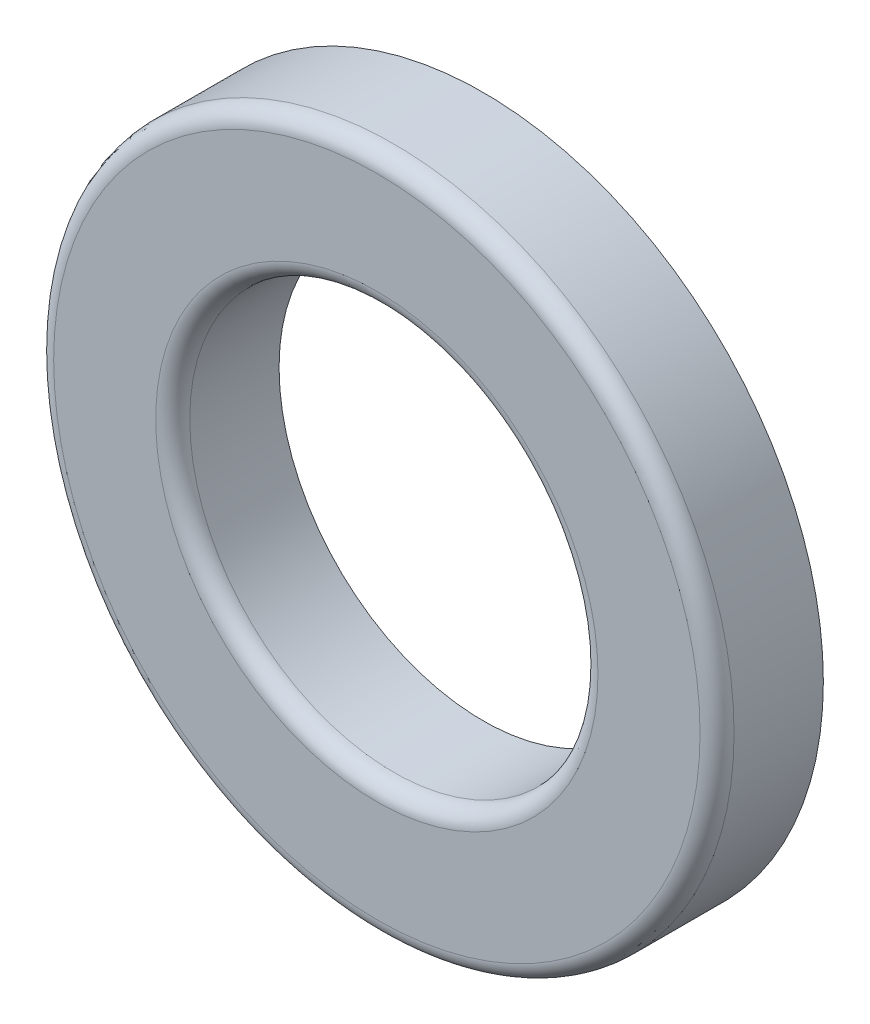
SolidWorks part; units mm, degrees
ref_plane "Front Plane" through (0, 0, 0) normal (0, 0, 1) x (1, 0, 0)
ref_plane "Top Plane" through (0, 0, 0) normal (0, 1, 0) x (1, 0, 0)
ref_plane "Right Plane" through (0, 0, 0) normal (1, 0, 0) x (0, 0, -1)
sketch "Sketch1" plane through (0, 0, 0) normal (0, 0, 1) x (1, 0, 0)
  circle A0 centre (0, 0) radius 2.54
  circle A1 centre (0, 0) radius 1.524
  dimension "D1" = 3.048
  dimension "D2" = 5.08
extrude "Extrude1" add sketch "Sketch1" along normal blind 0.7937
fillet "Fillet1" radius 0.127 2 edges at (1.524, 0, 0.7937) (2.54, 0, 0.7937)
